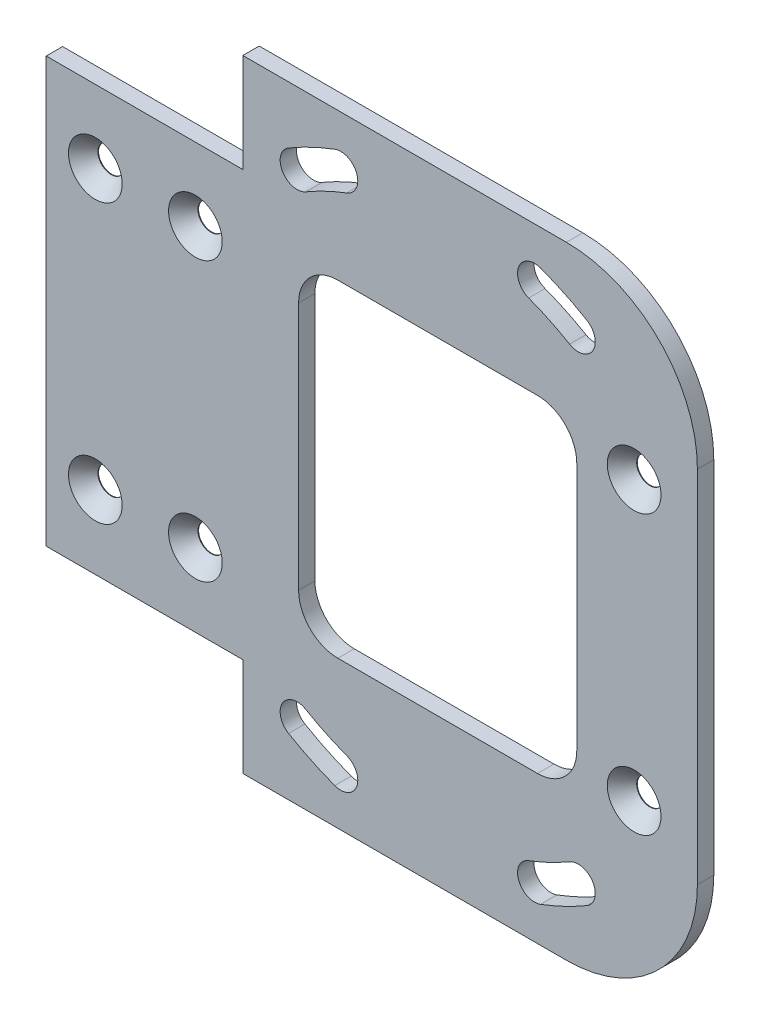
SolidWorks part; units mm, degrees
ref_plane "Front Plane" through (0, 0, 0) normal (0, 0, 1) x (1, 0, 0)
ref_plane "Top Plane" through (0, 0, 0) normal (0, 1, 0) x (1, 0, 0)
ref_plane "Right Plane" through (0, 0, 0) normal (1, 0, 0) x (0, 0, -1)
ref_plane "Plane1" through (0, 0, 3.175) normal (0, 0, 1) x (1, 0, 0)
sketch "Sketch1" plane through (0, 0, 3.175) normal (0, 0, 1) x (1, 0, 0)
  line L0 (-75.9206, -41.219) -> (-75.9206, 41.1158)
  line L1 (-75.9206, -41.219) -> (-37.7871, -41.219)
  line L2 (-37.7871, -41.219) -> (-37.7871, -60.3261)
  line L3 (-75.9206, 41.1158) -> (-37.7871, 41.1158)
  line L4 (-37.7871, 41.1158) -> (-37.7871, 60.2745)
  line L5 (50.3709, -60.3261) -> (-37.7871, -60.3261)
  line L6 (50.3709, -60.3261) -> (50.3709, 60.2745)
  line L11 (-37.7871, 60.2745) -> (50.3709, 60.2745)
extrude "Boss-Extrude1" add sketch "Sketch1" against normal blind 3.175
sketch "Sketch6" plane through (0, 0, 3.175) normal (0, 0, 1) x (1, 0, 0)
  line L0 (-26.9748, 31.75) -> (-26.9748, -31.75)
  line L1 (-26.9748, -31.75) -> (26.9748, -31.75)
  line L2 (26.9748, -31.75) -> (26.9748, 31.75)
  line L3 (26.9748, 31.75) -> (-26.9748, 31.75)
extrude "Cut-Extrude3" cut sketch "Sketch6" against normal through all
sketch "Sketch7" plane through (0, 0, 3.175) normal (0, 0, 1) x (1, 0, 0)
  arc A0 (-17.6427, 47.2505) -> (-19.9528, 53.4373) centre (-18.7978, 50.3439) ccw
  arc A1 (-19.9528, 53.4373) -> (-28.929, 49.1607) centre (0, 0) ccw
  arc A2 (-28.929, 49.1607) -> (-25.5797, 43.469) centre (-27.2543, 46.3149) ccw
  arc A3 (-25.5797, 43.469) -> (-17.6427, 47.2505) centre (0, 0) cw
extrude "Cut-Extrude4" cut sketch "Sketch7" against normal through all
sketch "Sketch8" plane through (0, 0, 3.175) normal (0, 0, 1) x (1, 0, 0)
  arc A0 (28.929, 49.1607) -> (19.9528, 53.4373) centre (0, 0) ccw
  arc A1 (19.9528, 53.4373) -> (17.6427, 47.2505) centre (18.7978, 50.3439) ccw
  arc A2 (17.6427, 47.2505) -> (25.5797, 43.469) centre (0, 0) cw
  arc A3 (25.5797, 43.469) -> (28.929, 49.1607) centre (27.2543, 46.3149) ccw
extrude "Cut-Extrude5" cut sketch "Sketch8" against normal through all
sketch "Sketch9" plane through (0, 0, 3.175) normal (0, 0, 1) x (1, 0, 0)
  arc A0 (-19.9528, -53.4373) -> (-17.6427, -47.2505) centre (-18.7978, -50.3439) ccw
  arc A1 (-17.6427, -47.2505) -> (-25.5797, -43.469) centre (0, 0) cw
  arc A2 (-25.5797, -43.469) -> (-28.929, -49.1607) centre (-27.2543, -46.3149) ccw
  arc A3 (-28.929, -49.1607) -> (-19.9528, -53.4373) centre (0, 0) ccw
extrude "Cut-Extrude6" cut sketch "Sketch9" against normal through all
sketch "Sketch10" plane through (0, 0, 0) normal (0, 0, -1) x (-1, 0, 0)
  arc A0 (-17.6427, -47.2505) -> (-25.5797, -43.469) centre (0, 0) cw
  arc A1 (-25.5797, -43.469) -> (-28.929, -49.1607) centre (-27.2543, -46.3149) ccw
  arc A2 (-28.929, -49.1607) -> (-19.9528, -53.4373) centre (0, 0) ccw
  arc A3 (-19.9528, -53.4373) -> (-17.6427, -47.2505) centre (-18.7978, -50.3439) ccw
extrude "Cut-Extrude7" cut sketch "Sketch10" against normal through all
hole_wizard "Hole1" positions "Sketch14" profile "Sketch13" legacy
sketch "Sketch14" plane through (0, 0, 3.175) normal (0, 0, 1) x (1, 0, 0)
  point P0 (-46.99, 26.9875)
  point P1 (-66.3956, 26.9875)
  point P2 (-46.99, -26.9875)
  point P3 (-66.3956, -26.9875)
  point P4 (38.1, 26.9875)
  point P5 (38.1, -26.9875)
  dimension "D1" = 19.4056
  dimension "D2" = 19.4056
sketch "Sketch13" plane through (-46.99, 26.9875, 3.175) normal (1, 0, 0) x (0, -1, 0)
  line L0 (0, 0) -> (0, 3.175)
  line L1 (0, 3.175) -> (2.5527, 3.175)
  line L2 (2.5527, 3.175) -> (2.5527, 3.0534)
  line L3 (2.5527, 3.0534) -> (5.207, 0)
  line L4 (5.207, 0) -> (0, 0)
  line L5 (0, -6.4453) -> (0, 115.525) construction
  line L6 (-2.5527, 3.0534) -> (-5.207, 0) construction
  dimension "Diameter" = 5.1054
  dimension "Depth" = 3.175
  dimension "C-Sink Angle" = 82
  dimension "C-Sink Diameter" = 10.414
fillet "Fillet3" radius 7.62 4 edges at (26.9748, -31.75, 1.5875) (-26.9748, -31.75, 1.5875) (-26.9748, 31.75, 1.5875) (26.9748, 31.75, 1.5875)
fillet "Fillet6" radius 25.4 2 edges at (50.3709, -60.3261, 1.5875) (50.3709, 60.2745, 1.5875)
